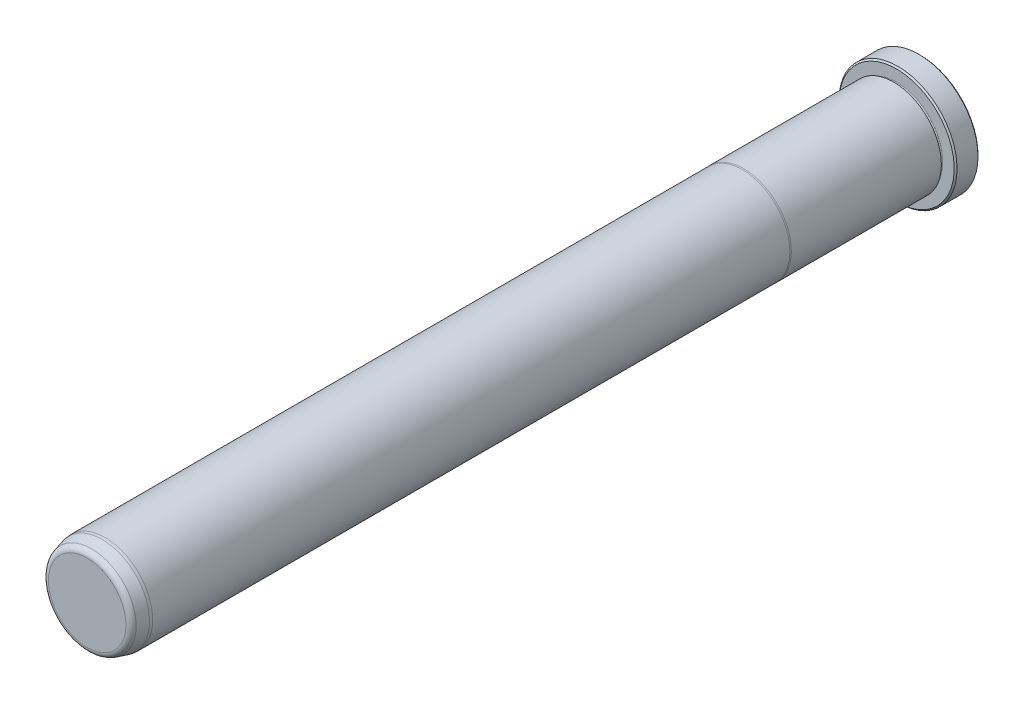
SolidWorks part; units mm, degrees
ref_plane "Front Plane" through (0, 0, 0) normal (0, 0, 1) x (1, 0, 0)
ref_plane "Top Plane" through (0, 0, 0) normal (0, 1, 0) x (1, 0, 0)
ref_plane "Right Plane" through (0, 0, 0) normal (1, 0, 0) x (0, 0, -1)
sketch "Sketch1" plane through (0, 0, 0) normal (1, 0, 0) x (0, 0, -1)
  line L0 (0, 0) -> (0, 15.748)
  line L1 (0, 15.748) -> (-6.35, 15.748)
  line L2 (-6.35, 15.748) -> (-6.35, 12.3063)
  line L3 (-6.35, 11.9253) -> (-7.112, 11.9253) construction
  line L4 (-7.112, 12.3063) -> (-7.112, 12.7127)
  line L5 (-7.112, 12.7127) -> (-47.1348, 12.7127)
  line L6 (-47.1348, 12.7127) -> (-47.498, 12.6873)
  line L7 (-47.498, 12.6873) -> (-217.4875, 12.6873)
  line L9 (-222.25, 11.5487) -> (-222.25, 0)
  line L10 (-222.25, 0) -> (0, 0)
  line L11 (0, 0) -> (13.6287, 0) construction
  line L12 (-217.4875, 12.6873) -> (-218.2495, 12.6206)
  line L13 (-218.2495, 12.6206) -> (-222.25, 11.5487)
  arc A0 (-7.112, 12.3063) -> (-6.35, 12.3063) centre (-6.731, 12.3063) ccw
  dimension "D14" = 0.762
  dimension "D1" = 6.35
  dimension "D2" = 0.762
  dimension "D3" = 31.496
  dimension "D4" = 25.4254
  dimension "D5" = 47.498
  dimension "D6" = 222.25
  dimension "D7" = 0.7874
  dimension "D8" = 4
  dimension "D9" = 25.3746
  dimension "D10" = 5
  dimension "D11" = 15
  dimension "D12" = 0.762
  dimension "D13" = 4.7625
revolve "Revolve1" add sketch "Sketch1" angle 360 about L11
fillet "Fillet6" radius 1.5875 1 edges at (11.5487, 0, 222.25)
chamfer "Chamfer1" distance 0.381 angle 45 2 edges at (15.748, 0, 0) (15.748, 0, 6.35)
